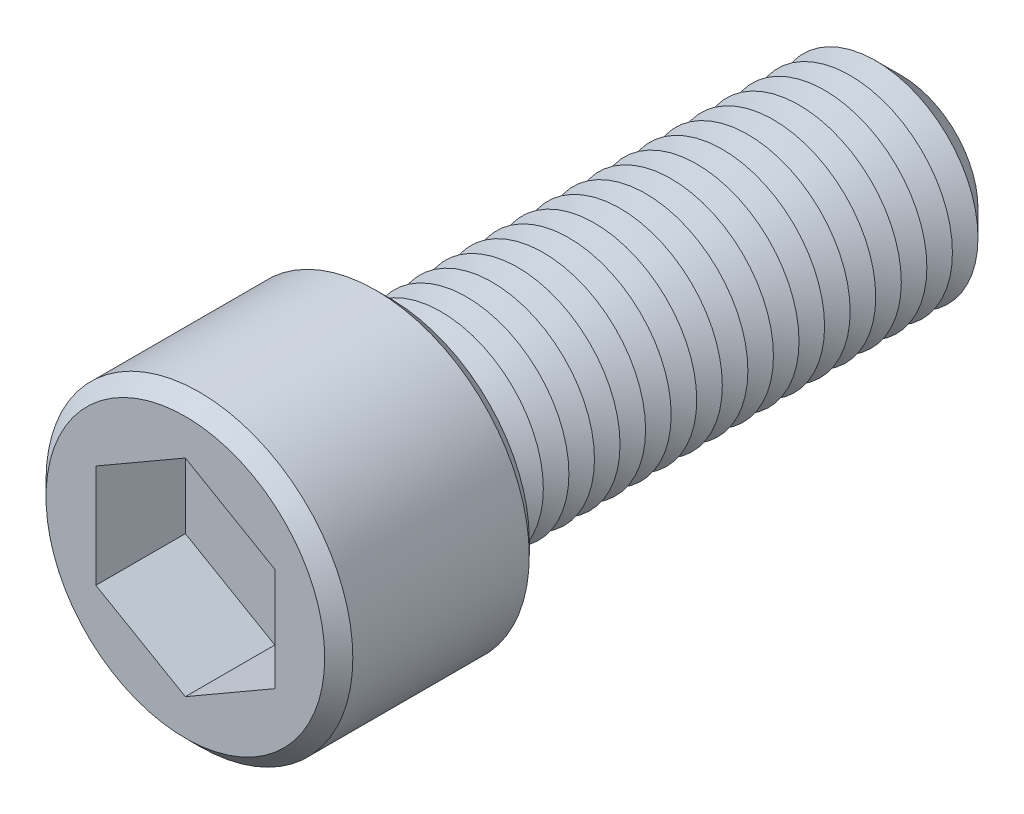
SolidWorks part; units mm, degrees
ref_plane "Front Plane" through (0, 0, 0) normal (0, 0, 1) x (1, 0, 0)
ref_plane "Top Plane" through (0, 0, 0) normal (0, 1, 0) x (1, 0, 0)
ref_plane "Right Plane" through (0, 0, 0) normal (1, 0, 0) x (0, 0, -1)
sketch "Sketch1" plane through (0, 0, 0) normal (0, 0, 1) x (1, 0, 0)
  circle A0 centre (0, 0) radius 12
  dimension "D1" = 24
extrude "Boss-Extrude1" add sketch "Sketch1" along normal blind 16
sketch "Sketch2" plane through (0, 0, 0) normal (0, 0, -1) x (-1, 0, 0)
  circle A0 centre (0, 0) radius 8
  dimension "D1" = 16
extrude "Boss-Extrude2" add sketch "Sketch2" along normal blind 40
chamfer "Chamfer1" distance 2 angle 45 1 edges at (-8, 0, -40)
sketch "Sketch3" plane through (0, 0, 0) normal (1, 0, 0) x (0, 0, -1)
  line L0 (-2.5121, 0) -> (4.5776, 0) construction
sketch "Sketch4" plane through (0, 0, 0) normal (1, 0, 0) x (0, 0, -1)
  line L0 (0, 8) -> (1, 6.2679)
  line L1 (1, 6.2679) -> (2, 8)
  line L2 (38, 8) -> (0, 8) construction
  line L3 (2, 8) -> (0, 8)
  dimension "D1" = 2
revolve "Cut-Revolve1" cut sketch "Sketch4" angle 360 about L0
pattern_linear "LPattern1" count 19 spacing 2 along (0, 0, -1) of "Cut-Revolve1"
sketch "Sketch5" plane through (0, 0, 16) normal (0, 0, 1) x (1, 0, 0)
  line L1 (0, 8.0829) -> (-7, 4.0415)
  line L2 (-7, 4.0415) -> (-7, -4.0415)
  line L3 (-7, -4.0415) -> (0, -8.0829)
  line L4 (0, -8.0829) -> (7, -4.0415)
  line L5 (7, -4.0415) -> (7, 4.0415)
  line L6 (7, 4.0415) -> (0, 8.0829)
  circle A0 centre (0, 0) radius 7 construction
  dimension "D1" = 14
extrude "Cut-Extrude1" cut sketch "Sketch5" against normal blind 7
sketch "Sketch6" plane through (0, 0, 9) normal (0, 0, 1) x (1, 0, 0)
  circle A0 centre (0, 0) radius 0.9
  dimension "D1" = 1.8
extrude "Cut-Extrude2" cut sketch "Sketch6" against normal up to surface (49 mm away)
chamfer "Chamfer2" distance 1.1 angle 45 2 edges at (12, 0, 0) (12, 0, 16)
